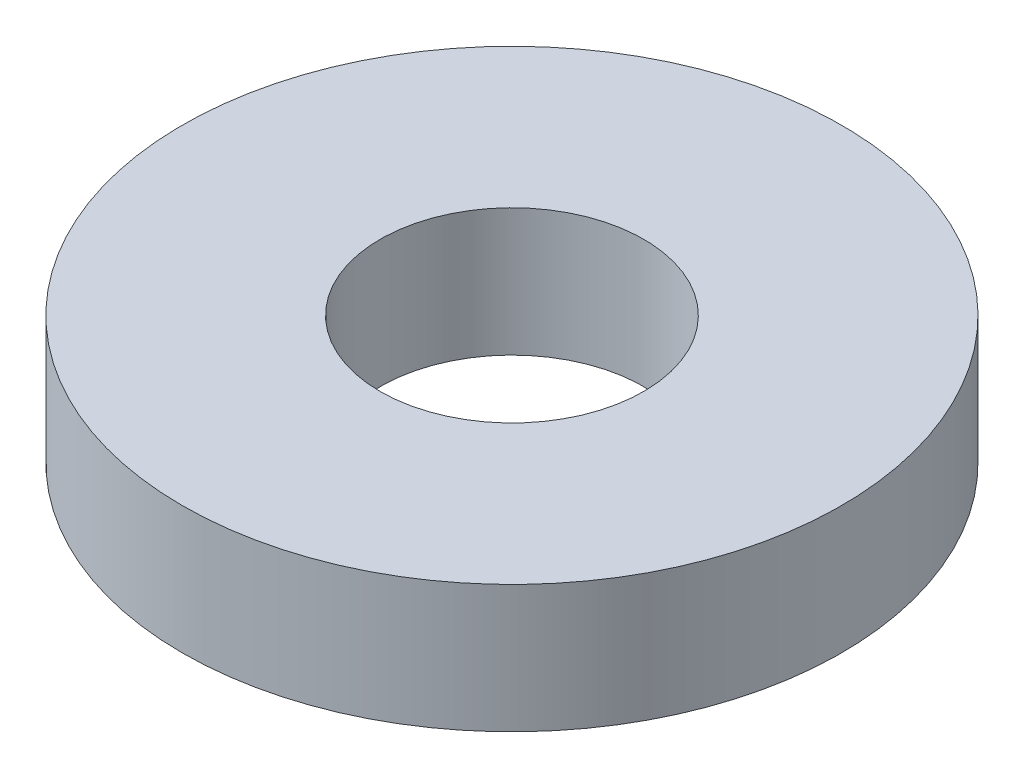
SolidWorks part; units mm, degrees
ref_plane "Front Plane" through (0, 0, 0) normal (0, 0, 1) x (1, 0, 0)
ref_plane "Top Plane" through (0, 0, 0) normal (0, 1, 0) x (1, 0, 0)
ref_plane "Right Plane" through (0, 0, 0) normal (1, 0, 0) x (0, 0, -1)
sketch "Sketch1" plane through (0, 0, 0) normal (0, 1, 0) x (1, 0, 0)
  circle A0 centre (0, 0) radius 7.9375
  dimension "OD" = 15.875
extrude "Boss-Extrude1" add sketch "Sketch1" along normal blind 3.0734
sketch "Sketch5" plane through (0, 3.0734, 0) normal (0, 1, 0) x (-1, 0, 0)
  circle A0 centre (0, 0) radius 3.175
  dimension "ID" = 6.35
extrude "Cut-Extrude1" cut sketch "Sketch5" against normal through all
